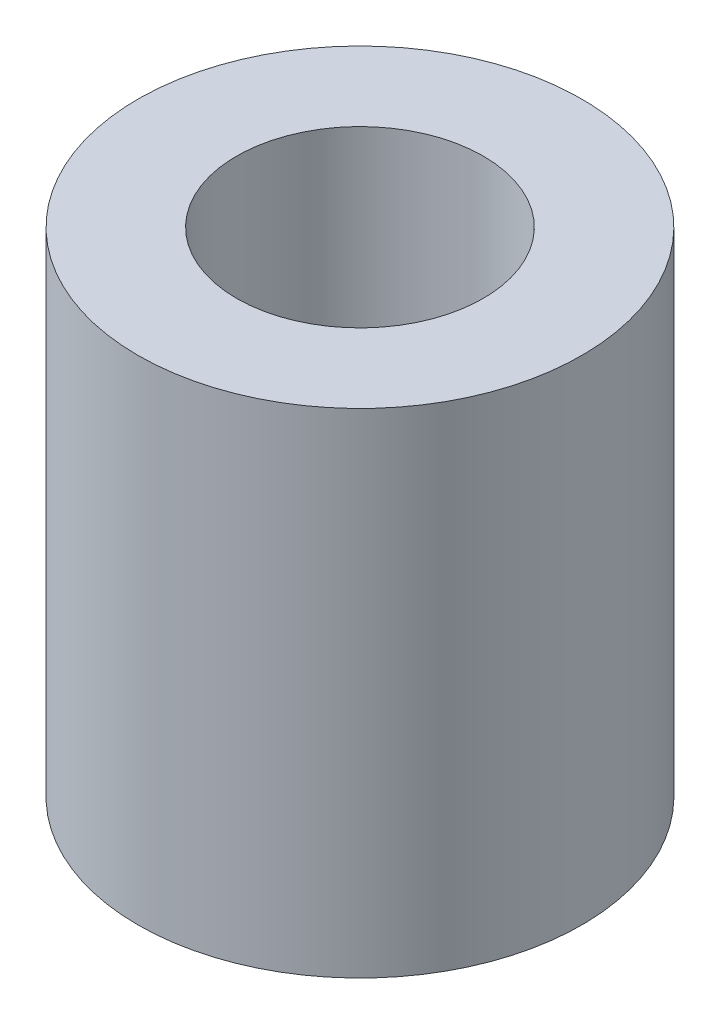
SolidWorks part; units mm, degrees
ref_plane "Front Plane" through (0, 0, 0) normal (0, 0, 1) x (1, 0, 0)
ref_plane "Top Plane" through (0, 0, 0) normal (0, 1, 0) x (1, 0, 0)
ref_plane "Right Plane" through (0, 0, 0) normal (1, 0, 0) x (0, 0, -1)
sketch "Sketch1" plane through (0, 0, 0) normal (0, 1, 0) x (1, 0, 0)
  circle A0 centre (0, 0) radius 2.5
  circle A1 centre (0, 0) radius 4.5
  dimension "D1" = 5
  dimension "D2" = 9
extrude "Boss-Extrude1" add sketch "Sketch1" along normal mid plane 10
